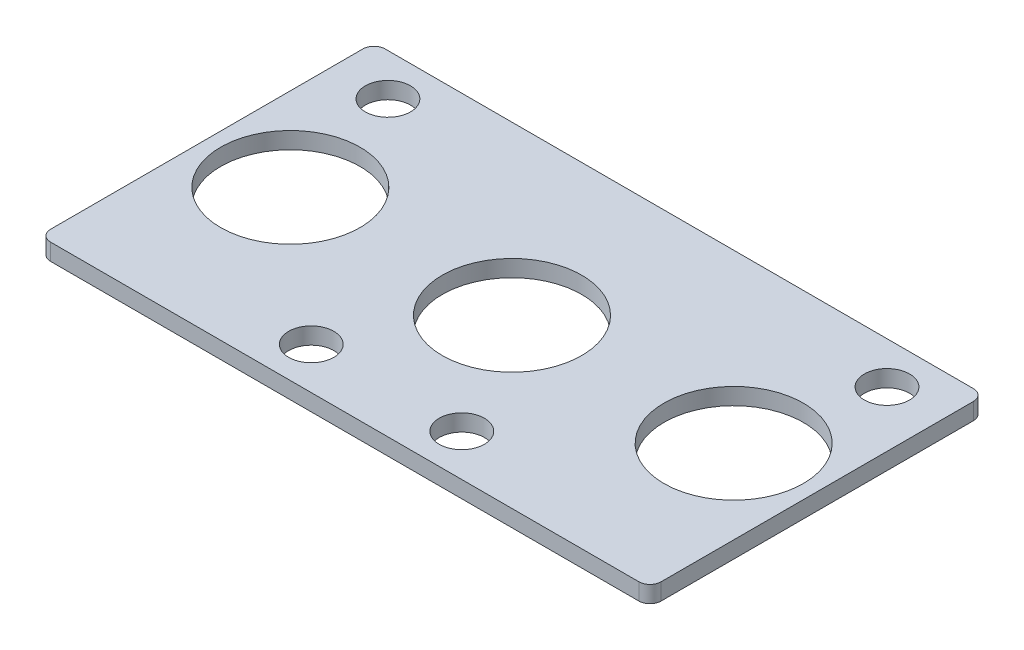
SolidWorks part; units mm, degrees
ref_plane "Piano frontale" through (0, 0, 0) normal (0, 0, 1) x (1, 0, 0)
ref_plane "Piano superiore" through (0, 0, 0) normal (0, 1, 0) x (1, 0, 0)
ref_plane "Piano destro" through (0, 0, 0) normal (1, 0, 0) x (0, 0, -1)
sketch "Schizzo1" plane through (0, 0, 0) normal (0, 1, 0) x (1, 0, 0)
  line L0 (3102.3698, 1957.3527) -> (2996.871, 1957.3527)
  line L1 (3102.3698, 2017.3527) -> (2996.871, 2017.3527)
  line L2 (2994.871, 2015.3527) -> (2994.871, 1959.3527)
  line L3 (3104.3698, 2015.3527) -> (3104.3698, 1959.3527)
  arc A0 (2994.871, 1959.3527) -> (2996.871, 1957.3527) centre (2996.871, 1959.3527) ccw
  arc A1 (2996.871, 2017.3527) -> (2994.871, 2015.3527) centre (2996.871, 2015.3527) ccw
  circle A2 centre (3036.1204, 1964.8527) radius 4.05
  circle A3 centre (3063.1204, 1964.8527) radius 4.05
  circle A4 centre (3004.871, 2009.8527) radius 4.05
  arc A5 (3104.3698, 2015.3527) -> (3102.3698, 2017.3527) centre (3102.3698, 2015.3527) ccw
  arc A6 (3102.3698, 1957.3527) -> (3104.3698, 1959.3527) centre (3102.3698, 1959.3527) ccw
  circle A7 centre (3094.3698, 2009.8527) radius 4.05
  circle A8 centre (3049.6204, 1987.3527) radius 12.5
  circle A9 centre (3009.871, 1987.3527) radius 12.5
  circle A10 centre (3089.3698, 1987.3527) radius 12.5
extrude "Estrusione-Estrusione1" add sketch "Schizzo1" along normal blind 3
